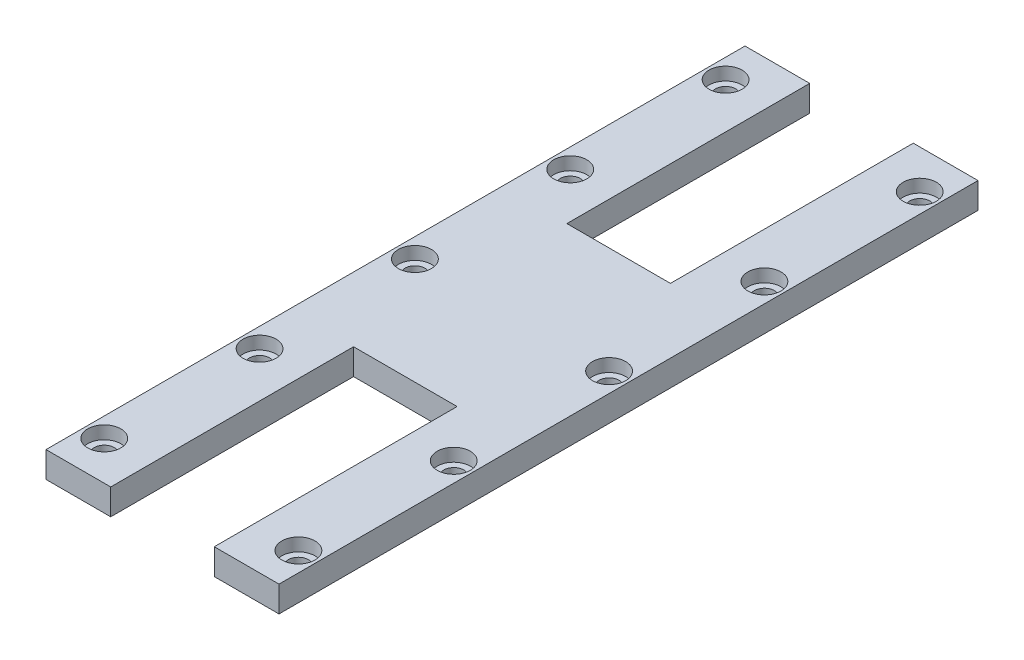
SolidWorks part; units mm, degrees
ref_plane "Front Plane" through (0, 0, 0) normal (0, 0, 1) x (1, 0, 0)
ref_plane "Top Plane" through (0, 0, 0) normal (0, 1, 0) x (1, 0, 0)
ref_plane "Right Plane" through (0, 0, 0) normal (1, 0, 0) x (0, 0, -1)
sketch "Sketch1" plane through (0, 0, 0) normal (0, 0, 1) x (1, 0, 0)
  line L1 (0, 0) -> (57.15, 0)
  line L2 (0, 0) -> (0, 6.35)
  line L3 (0, 6.35) -> (57.15, 6.35)
  line L4 (57.15, 0) -> (57.15, 6.35)
  dimension "D1" = 57.15
  dimension "D2" = 6.35
extrude "Boss-Extrude1" add sketch "Sketch1" against normal blind 171.45
sketch "Sketch2" plane through (0, 6.35, 0) normal (0, 1, 0) x (1, 0, 0)
  line L0 (57.15, 171.45) -> (0, 171.45) construction
  line L1 (15.875, 171.45) -> (41.275, 171.45)
  line L2 (15.875, 171.45) -> (15.875, 111.887)
  line L3 (15.875, 111.887) -> (41.275, 111.887)
  line L4 (41.275, 171.45) -> (41.275, 111.887)
  line L5 (57.15, 0) -> (0, 0) construction
  line L6 (15.875, 0) -> (41.275, 0)
  line L7 (15.875, 0) -> (15.875, 59.563)
  line L8 (15.875, 59.563) -> (41.275, 59.563)
  line L9 (41.275, 0) -> (41.275, 59.563)
  line L10 (0, 171.45) -> (0, 0) construction
  dimension "D1" = 25.4
  dimension "D2" = 25.4
  dimension "D3" = 59.563
  dimension "D4" = 59.563
  dimension "D5" = 15.875
  dimension "D6" = 15.875
extrude "Cut-Extrude1" cut sketch "Sketch2" against normal blind 127
sketch "Sketch3" plane through (0, 6.35, 0) normal (0, 1, 0) x (1, 0, 0)
  line L0 (15.875, 171.45) -> (0, 171.45) construction
  line L2 (0, 171.45) -> (0, 0) construction
  line L3 (57.15, 171.45) -> (57.15, 0) construction
  line L4 (57.15, 171.45) -> (41.275, 171.45) construction
  circle A0 centre (4.7625, 161.925) radius 2.4574
  circle A1 centre (4.7625, 123.825) radius 2.4574
  circle A2 centre (4.7625, 85.725) radius 2.4574
  circle A3 centre (4.7625, 47.625) radius 2.4575
  circle A4 centre (52.3875, 123.825) radius 2.4574
  circle A5 centre (52.3875, 85.725) radius 2.4574
  circle A6 centre (52.3875, 47.625) radius 2.4575
  circle A7 centre (52.3875, 9.525) radius 2.4574
  circle A8 centre (4.7625, 9.525) radius 2.4574
  circle A9 centre (52.3875, 161.925) radius 2.4574
  dimension "D1" = 9.525
  dimension "D2" = 38.1
  dimension "D3" = 38.1
  dimension "D4" = 38.1
  dimension "D5" = 4.9149
  dimension "D6" = 4.9149
  dimension "D7" = 4.9149
  dimension "D8" = 4.9149
  dimension "D9" = 4.7625
  dimension "D10" = 4.9149
  dimension "D11" = 4.9149
  dimension "D12" = 4.9149
  dimension "D13" = 4.9149
  dimension "D14" = 4.9149
  dimension "D20" = 4.9149
  dimension "D21" = 38.1
  dimension "D22" = 38.1
  dimension "D25" = 38.1
  dimension "D15" = 38.1
  dimension "D16" = 4.7625
  dimension "D17" = 4.7625
  dimension "D18" = 4.7625
  dimension "D19" = 4.7625
  dimension "D23" = 38.1
  dimension "D24" = 9.525
extrude "Cut-Extrude2" cut sketch "Sketch3" against normal blind 6.35
sketch "Sketch4" plane through (0, 6.35, 0) normal (0, 1, 0) x (1, 0, 0)
  circle A0 centre (4.7625, 161.925) radius 4.064
  circle A1 centre (4.7625, 123.825) radius 4.064
  circle A2 centre (4.7625, 85.725) radius 4.064
  circle A3 centre (4.7625, 47.625) radius 4.064
  circle A4 centre (52.3875, 9.525) radius 4.064
  circle A5 centre (52.3875, 47.625) radius 4.064
  circle A6 centre (52.3875, 85.725) radius 4.064
  circle A7 centre (52.3875, 123.825) radius 4.064
  circle A8 centre (52.3875, 161.925) radius 4.064
  circle A9 centre (4.7625, 9.525) radius 4.064
  dimension "D1" = 8.128
  dimension "D2" = 8.128
  dimension "D3" = 8.128
  dimension "D4" = 8.128
  dimension "D5" = 8.128
  dimension "D6" = 8.128
  dimension "D7" = 8.128
  dimension "D8" = 8.128
  dimension "D9" = 8.128
  dimension "D10" = 8.128
extrude "Cut-Extrude3" cut sketch "Sketch4" against normal blind 3.175
